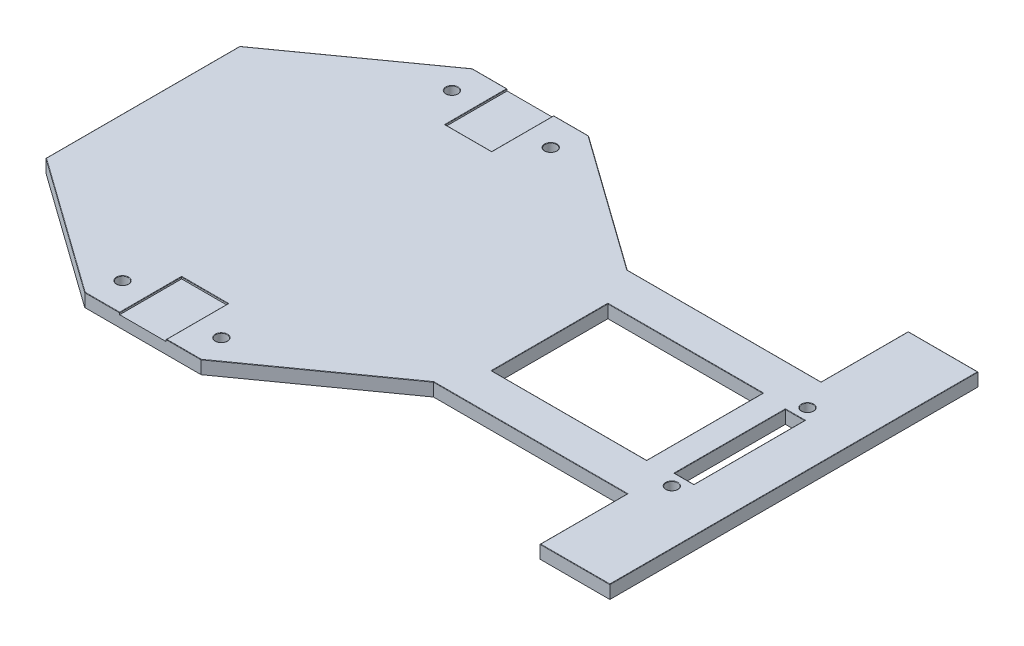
SolidWorks part; units mm, degrees
ref_plane "Alzado" through (0, 0, 0) normal (0, 0, 1) x (1, 0, 0)
ref_plane "Planta" through (0, 0, 0) normal (0, 1, 0) x (1, 0, 0)
ref_plane "Vista lateral" through (0, 0, 0) normal (1, 0, 0) x (0, 0, -1)
sketch "Croquis1" plane through (0, 0, 0) normal (0, 1, 0) x (1, 0, 0)
  line L0 (0, 0) -> (0, 50)
  line L1 (0, 50) -> (35, 75)
  line L2 (35, 75) -> (65, 75)
  line L3 (65, 75) -> (100, 50)
  line L4 (100, 50) -> (150, 50)
  line L5 (150, 50) -> (150, 72.5)
  line L6 (150, 72.5) -> (168, 72.5)
  line L7 (168, 72.5) -> (168, -22.5)
  line L8 (168, -22.5) -> (150, -22.5)
  line L9 (150, -22.5) -> (150, 0)
  line L10 (150, 0) -> (100, 0)
  line L11 (100, 0) -> (65, -25)
  line L12 (65, -25) -> (35, -25)
  line L13 (35, -25) -> (0, 0)
  line L14 (0, 25) -> (105, 25) construction
  line L15 (105, 10) -> (145, 10)
  line L20 (105, 10) -> (105, 40)
  line L21 (105, 40) -> (145, 40)
  line L22 (145, 10) -> (145, 40)
  line L23 (105, 10) -> (145, 40) construction
  line L24 (105, 40) -> (145, 10) construction
  line L25 (151.5, 10.7) -> (156.5, 10.7)
  line L26 (151.5, 10.7) -> (151.5, 39.3)
  line L27 (151.5, 39.3) -> (156.5, 39.3)
  line L28 (156.5, 10.7) -> (156.5, 39.3)
  line L29 (151.5, 10.7) -> (156.5, 39.3) construction
  line L30 (151.5, 39.3) -> (156.5, 10.7) construction
  circle A0 centre (154, 42.5) radius 1.5
  circle A1 centre (154, 7.5) radius 1.5
  circle A2 centre (37.25, 67.5) radius 1.5
  circle A3 centre (62.75, 67.5) radius 1.5
  circle A4 centre (62.75, -17.5) radius 1.5
  circle A5 centre (37.25, -17.5) radius 1.5
  point P10 (125, 25)
  point P17 (125, 25)
  point P21 (154, 25)
  dimension "D26" = 3
  dimension "D27" = 3
  dimension "D33" = 3
  dimension "D34" = 3
  dimension "D1" = 50
  dimension "D3" = 100
  dimension "D4" = 25
  dimension "D5" = 35
  dimension "D6" = 30
  dimension "D7" = 30
  dimension "D8" = 35
  dimension "D9" = 25
  dimension "D10" = 35
  dimension "D11" = 25
  dimension "D12" = 50
  dimension "D13" = 50
  dimension "D14" = 95
  dimension "D15" = 22.5
  dimension "D16" = 18
  dimension "D17" = 40
  dimension "D18" = 5
  dimension "D19" = 30
  dimension "D20" = 10
  dimension "D21" = 28.6
  dimension "D22" = 5
  dimension "D23" = 1.5
  dimension "D24" = 35
  dimension "D25" = 17.5
  dimension "D28" = 25
  dimension "D29" = 7.5
  dimension "D30" = 2.25
  dimension "D31" = 7.5
  dimension "D32" = 2.25
extrude "Saliente-Extruir1" add sketch "Croquis1" along normal blind 3.4
sketch "Croquis2" plane through (0, 3.4, 0) normal (0, 1, 0) x (1, 0, 0)
  line L0 (44, 75) -> (44, 59)
  line L1 (65, 75) -> (35, 75) construction
  line L2 (44, 59) -> (56, 59)
  line L3 (56, 59) -> (56, 75)
  line L4 (44, -25) -> (44, -9)
  line L5 (35, -25) -> (65, -25) construction
  line L6 (44, -9) -> (56, -9)
  line L7 (56, -9) -> (56, -25)
  line L8 (44, 75) -> (56, 75)
  line L9 (56, -25) -> (44, -25)
  dimension "D1" = 12
  dimension "D2" = 16
  dimension "D3" = 9
  dimension "D4" = 16
  dimension "D5" = 12
extrude "Cortar-Extruir1" cut sketch "Croquis2" against normal blind 0.5
fillet "Redondeo1" radius 0.1 36 edges at (50, 3.4, -59) (56, 3.4, -67) (60.5, 3.4, -75) (82.5, 3.4, -62.5) (125, 3.4, -50) (150, 3.4, -61.25) (159, 3.4, -72.5) (168, 3.4, -25) (159, 3.4, 22.5) (150, 3.4, 11.25) (125, 3.4, 0) (82.5, 3.4, 12.5) (60.5, 3.4, 25) (56, 3.4, 17) (50, 3.4, 9) (44, 3.4, 17) (39.5, 3.4, 25) (17.5, 3.4, 12.5) (0, 3.4, -25) (17.5, 3.4, -62.5) (39.5, 3.4, -75) (44, 3.4, -67) (37.25, 3.4, 16) (62.75, 3.4, 16) (62.75, 3.4, -66) (37.25, 3.4, -66) (154, 3.4, -41) (154, 3.4, -6) (154, 3.4, -39.3) (151.5, 3.4, -25) (154, 3.4, -10.7) (156.5, 3.4, -25) (125, 3.4, -40) (105, 3.4, -25) (125, 3.4, -10) (145, 3.4, -25)
